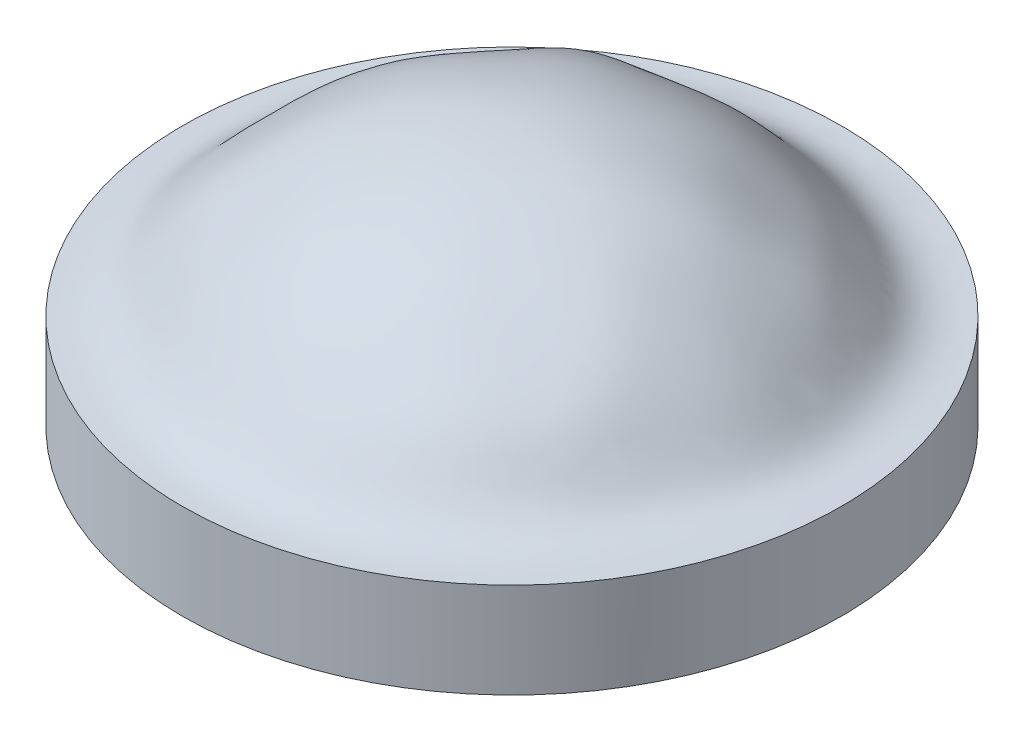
SolidWorks part; units mm, degrees
ref_plane "Front Plane" through (0, 0, 0) normal (0, 0, 1) x (1, 0, 0)
ref_plane "Top Plane" through (0, 0, 0) normal (0, 1, 0) x (1, 0, 0)
ref_plane "Right Plane" through (0, 0, 0) normal (1, 0, 0) x (0, 0, -1)
sketch "Sketch1" plane through (0, 0, 0) normal (0, 1, 0) x (1, 0, 0)
  circle A0 centre (0, 0) radius 34.6186
extrude "Extrude1" add sketch "Sketch1" along normal blind 10
other "Shape Feature1"
